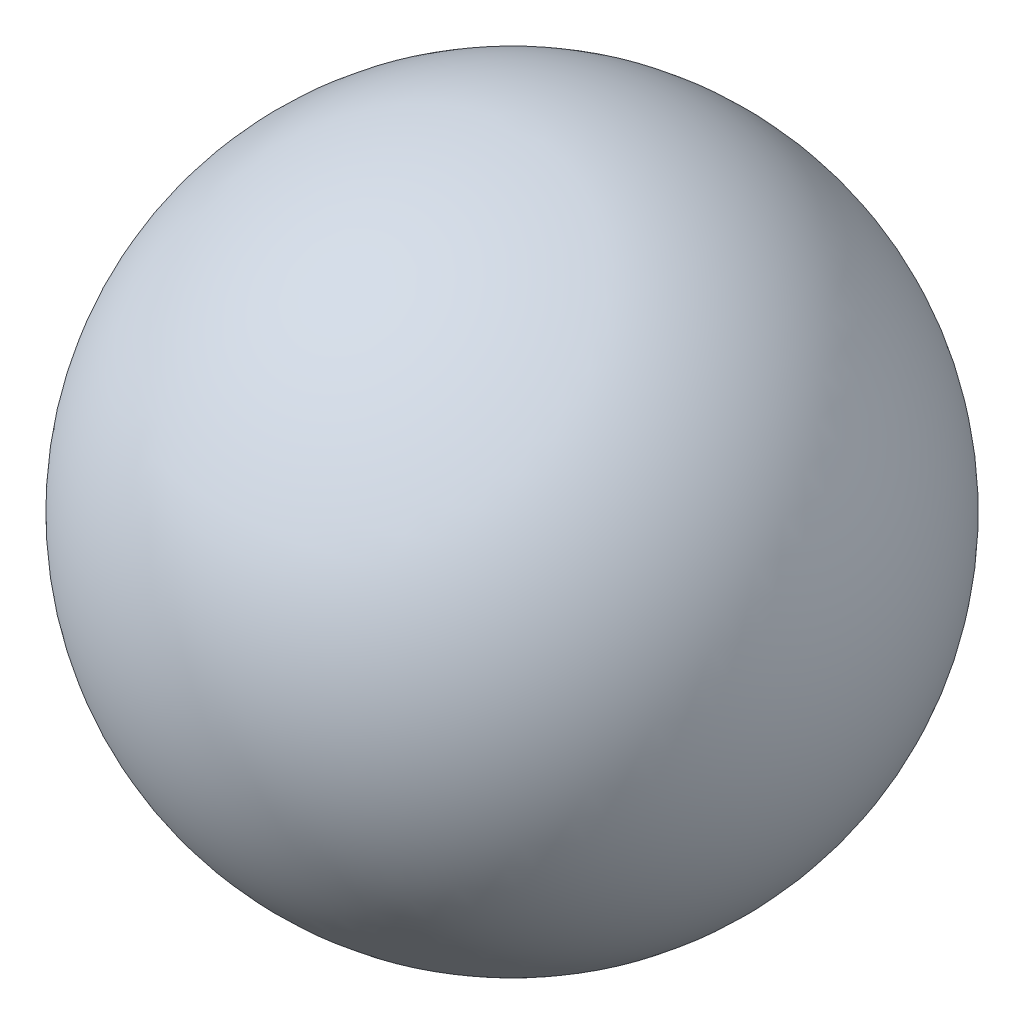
SolidWorks part; units mm, degrees
ref_plane "Plan1" through (0, 0, 0) normal (0, 0, 1) x (1, 0, 0)
ref_plane "Plan2" through (0, 0, 0) normal (0, 1, 0) x (1, 0, 0)
ref_plane "Plan3" through (0, 0, 0) normal (1, 0, 0) x (0, 0, -1)
sketch "Esquisse1" plane through (0, 0, 0) normal (0, 0, 1) x (1, 0, 0)
  line L0 (0, 3.5) -> (0, -20) construction
  line L1 (0, 3.5) -> (0, -3.5)
  arc A0 (0, 3.5) -> (0, -3.5) centre (0, 0) ccw
  dimension "D1" = 7
revolve "Base-Révolution" add sketch "Esquisse1" angle 360 about L0
